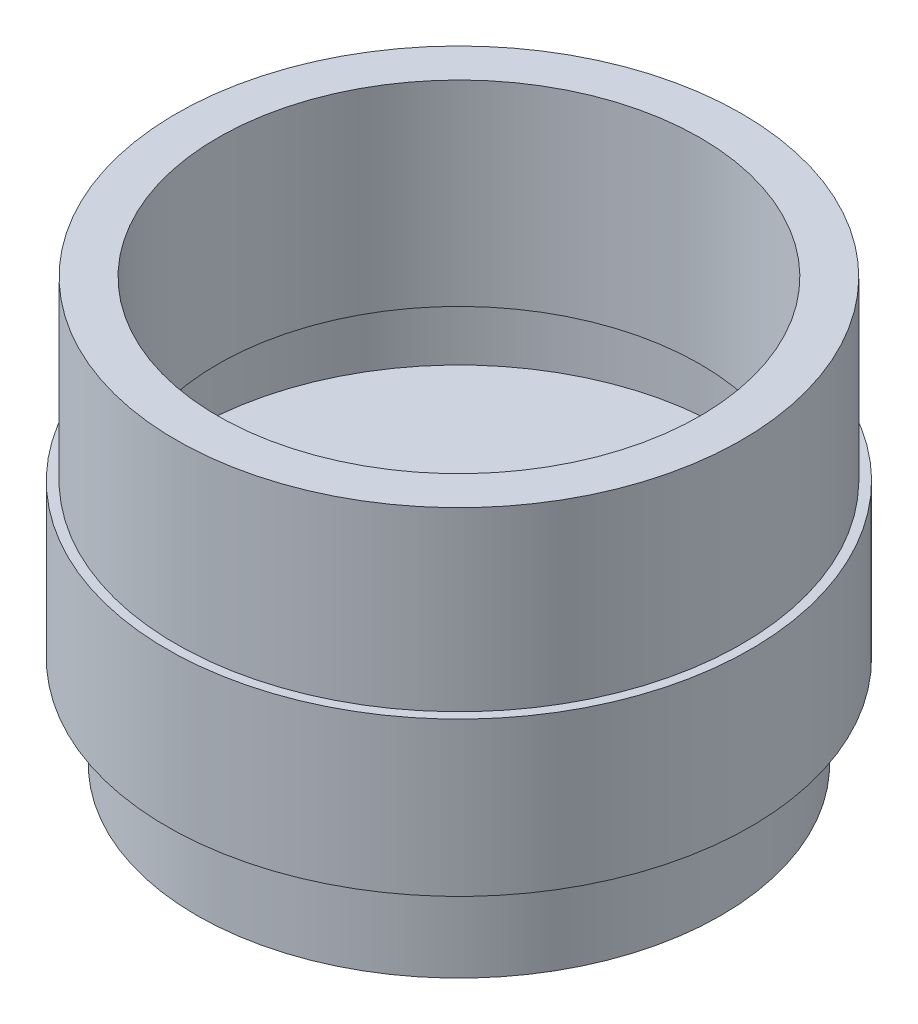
SolidWorks part; units mm, degrees
ref_plane "Front Plane" through (0, 0, 0) normal (0, 0, 1) x (1, 0, 0)
ref_plane "Top Plane" through (0, 0, 0) normal (0, 1, 0) x (1, 0, 0)
ref_plane "Right Plane" through (0, 0, 0) normal (1, 0, 0) x (0, 0, -1)
sketch "Sketch1" plane through (0, 0, 0) normal (0, 0, 1) x (1, 0, 0)
  line L0 (0, 0) -> (0, 14.2917) construction
  line L1 (5.588, 0) -> (7.9121, 0)
  line L2 (7.9121, 0) -> (7.9121, 2.7686)
  line L3 (7.9121, 2.7686) -> (8.8074, 2.7686)
  line L4 (8.8074, 2.7686) -> (8.8074, 7.4041)
  line L5 (8.8074, 7.4041) -> (8.5344, 7.4041)
  line L6 (8.5344, 7.4041) -> (8.5344, 12.7381)
  line L7 (8.5344, 12.7381) -> (7.2771, 12.7381)
  line L8 (7.2771, 12.7381) -> (7.2771, 6.8199)
  line L9 (7.2771, 6.8199) -> (8.02, 6.8199)
  line L10 (8.02, 6.8199) -> (8.02, 4.7625)
  line L11 (8.02, 4.7625) -> (3.9306, 4.7625)
  line L12 (3.9306, 4.7625) -> (3.9306, 1.6574)
  line L13 (3.9306, 1.6574) -> (5.588, 0)
  dimension "D1" = 15.8242
  dimension "D2" = 17.6149
  dimension "D3" = 17.0688
  dimension "D4" = 12.7381
  dimension "D5" = 9.9695
  dimension "D6" = 4.6355
  dimension "D7" = 14.5542
  dimension "D8" = 7.8613
  dimension "D9" = 7.9756
  dimension "D10" = 11.176
  dimension "D11" = 45
  dimension "D12" = 2.0574
  dimension "D13" = 0.7874
revolve "Revolve1" add sketch "Sketch1" angle 360 about L0
